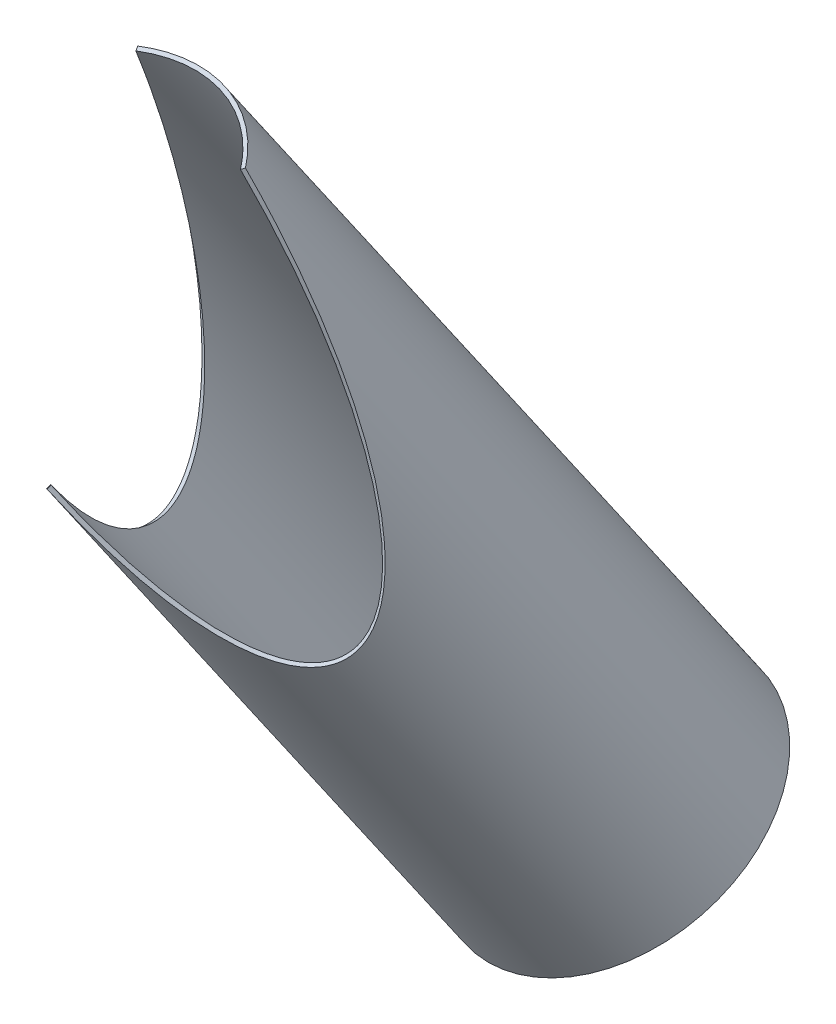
SolidWorks part; units mm, degrees
ref_plane "前视基准面" through (0, 0, 0) normal (0, 0, 1) x (1, 0, 0)
ref_plane "上视基准面" through (0, 0, 0) normal (0, 1, 0) x (1, 0, 0)
ref_plane "右视基准面" through (0, 0, 0) normal (1, 0, 0) x (0, 0, -1)
imported_body "基体零件-等径Y形五通管-1"
sheet metal parameters "钣金1" parameters "D1"=0.7366, "厚度"=6
bend "圆角折弯1" bend radius 204 bend angle 359.727 parameters "D5"=1
flatten bends "展开-折弯1"
sketch "尖角-草图1" plane through (76.0323, -748.5111, -232.3853) normal (-0.2552, -0.5528, 0.7933) x (0.9669, -0.1459, 0.2094)
  line L0 (552.4007, 547.2843) -> (708.2514, -321.0087) construction
  dimension "D1" = 0
process bends "加工-折弯1" parameters "D1"=0
sketch "平面-草图1" plane through (76.0323, -748.5111, -232.3853) normal (-0.2552, -0.5528, 0.7933) x (0.9669, -0.1459, 0.2094)
